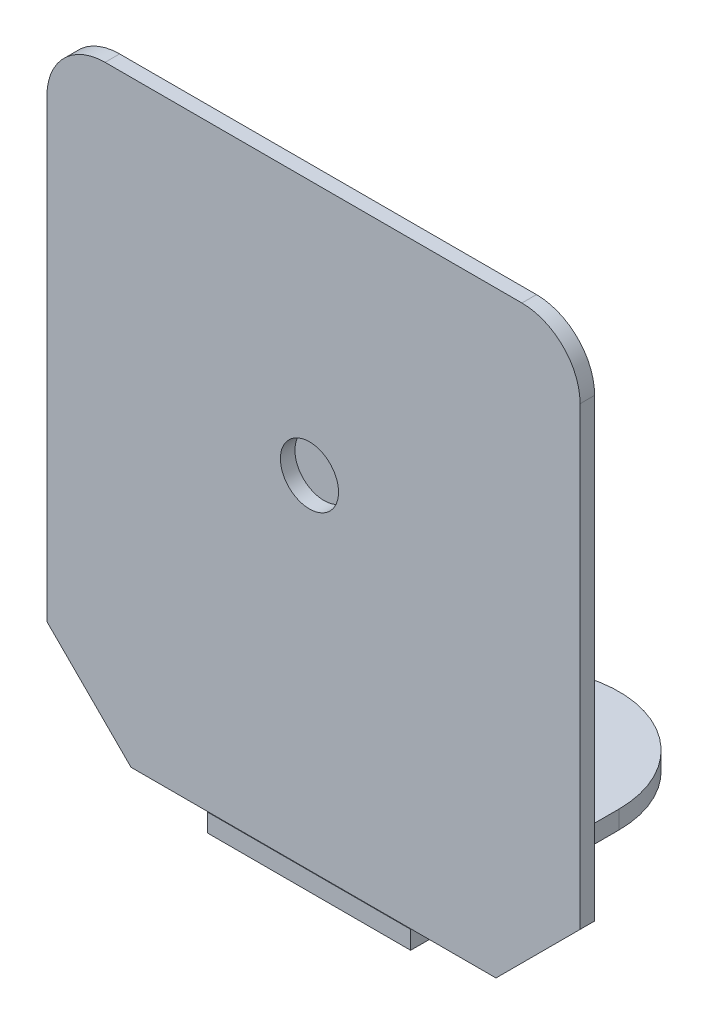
SolidWorks part; units mm, degrees
ref_plane "Plan de face" through (0, 0, 0) normal (0, 0, 1) x (1, 0, 0)
ref_plane "Plan de dessus" through (0, 0, 0) normal (0, 1, 0) x (1, 0, 0)
ref_plane "Plan de droite" through (0, 0, 0) normal (1, 0, 0) x (0, 0, -1)
sketch "Esquisse1" plane through (0, 0, 0) normal (0, 0, 1) x (1, 0, 0)
  line L0 (9.8798, -0.5625) -> (8.7228, -1.7195)
  line L1 (8.7228, -1.7195) -> (3.7028, -1.7195)
  line L2 (3.7028, -1.7195) -> (2.5458, -0.5625)
  line L3 (2.5458, -0.5625) -> (2.5458, 0)
  line L5 (2.5458, 0) -> (2.5458, 5.7)
  line L11 (9.8798, -0.5625) -> (9.8798, 5.7)
  line L12 (9.0798, 6.5) -> (3.3458, 6.5)
  line L13 (1.0458, 0) -> (1.0458, 10.0955) construction
  arc A0 (2.5458, 5.7) -> (3.3458, 6.5) centre (3.3458, 5.7) cw
  arc A1 (9.8798, 5.7) -> (9.0798, 6.5) centre (9.0798, 5.7) ccw
  circle A2 centre (6.1573, 2.9852) radius 0.4
  point P9 (1.0458, 6.5)
  point P21 (6.1573, 2.9852)
  dimension "D1" = 0.8
  dimension "D5" = 0.8
  dimension "D3" = 0.8
  dimension "D2" = 6.5
extrude "Extrusion1" add sketch "Esquisse1" along normal blind 0.2
sketch "Esquisse3" plane through (0, -1.7195, 0) normal (0, -1, 0) x (1, 0, 0)
  line L1 (6.1573, -9.6087) -> (6.1573, 0) construction
  line L7 (4.7584, 0.207) -> (4.7584, -2.6592)
  line L11 (7.5562, 0.207) -> (7.5562, -2.6592)
  line L12 (4.7584, 0.207) -> (7.5562, 0.207)
  arc A0 (7.5562, -2.6592) -> (4.7584, -2.6592) centre (6.1573, -2.6592) cw
extrude "Extrusion3" add sketch "Esquisse3" along normal blind 0.25
sketch "Esquisse4" plane through (0, 0, 0) normal (0, 0, -1) x (-1, 0, 0)
  circle A0 centre (-6.1949, 3.0085) radius 1.729
extrude "Extrusion4" add sketch "Esquisse4" along normal blind 0.4 draft 45
